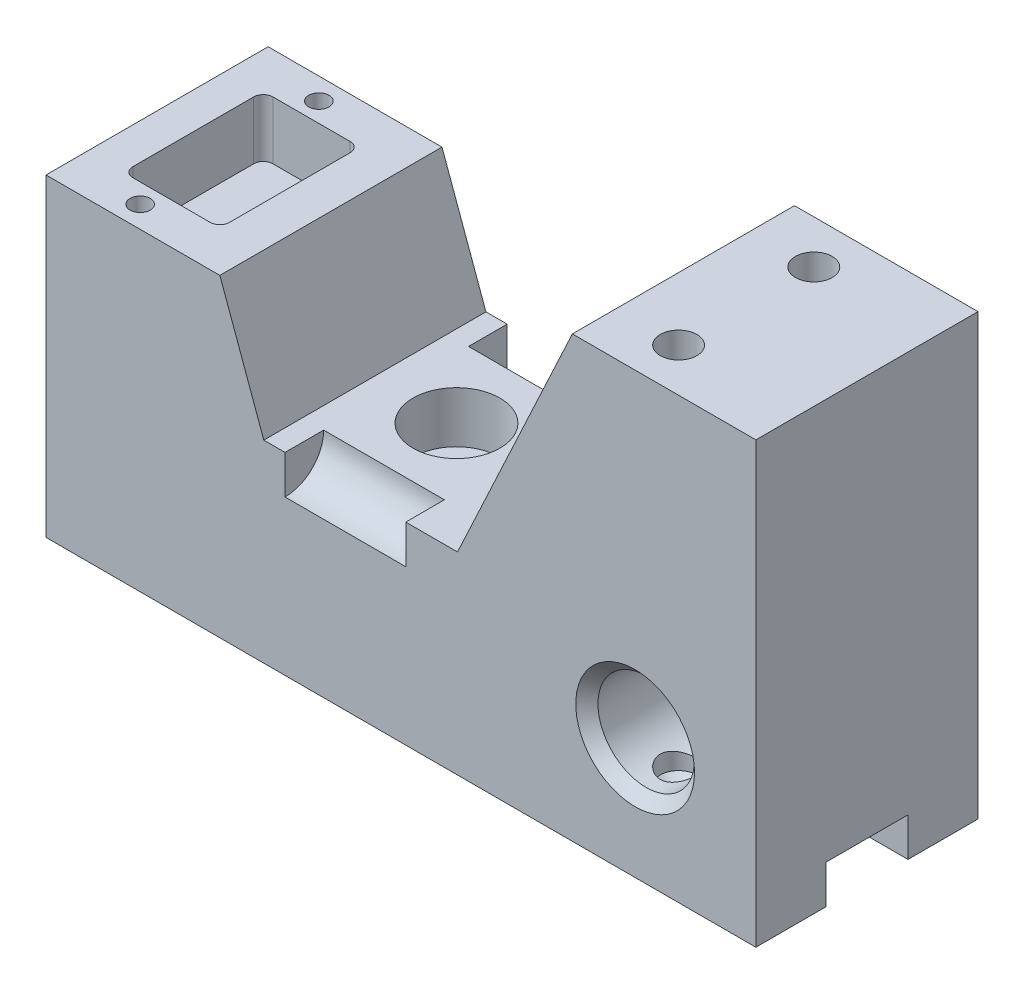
SolidWorks part; units mm, degrees
ref_plane "Front" through (0, 0, 0) normal (0, 0, 1) x (1, 0, 0)
ref_plane "Top" through (0, 0, 0) normal (0, 1, 0) x (1, 0, 0)
ref_plane "Right" through (0, 0, 0) normal (1, 0, 0) x (0, 0, -1)
sketch "Sketch1" plane through (0, 0, 0) normal (0, 0, 1) x (1, 0, 0)
  line L0 (0, 0) -> (0, 65)
  line L1 (0, 65) -> (36, 65)
  line L2 (36, 65) -> (45.0993, 40)
  line L3 (45.0993, 40) -> (85.2183, 40)
  line L4 (85.2183, 40) -> (109, 91)
  line L5 (109, 91) -> (147, 91)
  line L6 (147, 91) -> (147, 0)
  line L7 (147, 0) -> (0, 0)
  circle A0 centre (122, 25) radius 10
  dimension "D5" = 20
  dimension "D1" = 147
  dimension "D2" = 65
  dimension "D3" = 91
  dimension "D4" = 38
  dimension "D6" = 25
  dimension "D7" = 25
  dimension "D8" = 40
  dimension "D9" = 36
  dimension "D10" = 70
  dimension "D11" = 65
extrude "Boss-Extrude1" add sketch "Sketch1" along normal mid plane 46
chamfer "Chamfer1" distance 2.3 angle 45 2 edges at (132, 25, -23) (132, 25, 23)
sketch "Sketch2" plane through (0, 65, 0) normal (0, 1, 0) x (1, 0, 0)
  line L0 (36, -23) -> (0, -23) construction
  line L1 (7.5, 14.5) -> (27.5, 14.5)
  line L2 (7.5, 14.5) -> (7.5, -14.5)
  line L3 (7.5, -14.5) -> (27.5, -14.5)
  line L4 (27.5, 14.5) -> (27.5, -14.5)
  line L5 (7.5, 14.5) -> (27.5, -14.5) construction
  line L6 (7.5, -14.5) -> (27.5, 14.5) construction
  line L7 (0, -23) -> (0, 23) construction
  line L8 (17.5, -23) -> (17.5, -14.5) construction
  point P0 (17.5, 0)
  point P7 (17.5, -14.5)
  dimension "D1" = 8.5
  dimension "D2" = 7.5
  dimension "D3" = 20
  dimension "D4" = 29
extrude "Cut-Extrude1" cut sketch "Sketch2" against normal blind 12
fillet "Fillet1" radius 2 4 edges at (7.5, 59, 14.5) (27.5, 59, 14.5) (27.5, 59, -14.5) (7.5, 59, -14.5)
hole_wizard "Ø7.6 (7.6) Diameter Hole1" positions "Sketch3" profile "Sketch5" hole size "Ø7.6" standard "ISO"
sketch "Sketch3" plane through (0, 91, 0) normal (0, 1, 0) x (1, 0, 0)
  line L0 (122, -23) -> (122, -14) construction
  line L1 (147, -23) -> (109, -23) construction
  line L2 (122, -14) -> (122, 14) construction
  line L3 (122, 14) -> (122, 23) construction
  line L4 (147, 23) -> (109, 23) construction
  line L7 (147, -23) -> (147, 23) construction
  point P0 (122, -14)
  point P2 (122, 14)
  dimension "D1" = 9
  dimension "D2" = 25
sketch "Sketch5" plane through (122, 91, 14) normal (1, 0, 0) x (0, 0, 1)
  line L0 (0, 0) -> (0, 81.2833)
  line L1 (0, 81.2833) -> (3.8, 79)
  line L2 (3.8, 79) -> (3.8, 0)
  line L5 (3.8, 0) -> (0, 0)
  line L10 (0, 81.2833) -> (-3.8, 79) construction
  line L11 (0, -6.35) -> (0, 107.95) construction
  dimension "Hole Dia." = 7.6
  dimension "Hole Depth" = 79
  dimension "Drill Angle" = 118
sketch "Sketch6" plane through (147, 0, 0) normal (1, 0, 0) x (0, 0, -1)
  line L0 (-23, 0) -> (23, 0) construction
  line L1 (8.5, 0) -> (-8.5, 0)
  line L2 (8.5, 0) -> (8.5, 8)
  line L3 (8.5, 8) -> (-8.5, 8)
  line L4 (-8.5, 0) -> (-8.5, 8)
  dimension "D1" = 8
  dimension "D2" = 17
extrude "Cut-Extrude2" cut sketch "Sketch6" against normal through all
hole_wizard "CBORE for M10 Hex Socket Head Cap Screw1" positions "Sketch9" profile "Sketch8" counterbore size "M10" standard "ISO"
sketch "Sketch9" plane through (0, 40, 0) normal (0, 1, 0) x (1, 0, 0)
  line L0 (147, -23) -> (147, 23) construction
  point P0 (62, 0)
  dimension "D1" = 85
sketch "Sketch8" plane through (62, 40, 0) normal (1, 0, 0) x (0, 0, 1)
  line L0 (0, 0) -> (0, 86.3047)
  line L1 (0, 86.3047) -> (5.5, 83)
  line L2 (5.5, 83) -> (5.5, 10.6)
  line L3 (5.5, 10.6) -> (9, 10.6)
  line L4 (9, 10.6) -> (9, 0)
  line L5 (9, 0) -> (0, 0)
  line L10 (0, 86.3047) -> (-5.5, 83) construction
  line L11 (0, -6.35) -> (0, 107.95) construction
  dimension "Hole Dia." = 11
  dimension "Hole Depth" = 83
  dimension "C'Bore Dia." = 18
  dimension "C'Bore Depth" = 10.6
  dimension "Drill Angle" = 118
hole_wizard "M5 Tapped Hole1" positions "Sketch10" profile "Sketch11" tap size "M5" standard "ISO"
sketch "Sketch10" plane through (0, 65, 0) normal (0, 1, 0) x (1, 0, 0)
  line L0 (15, -23) -> (15, -18.5) construction
  line L1 (36, -23) -> (0, -23) construction
  line L3 (15, 18.5) -> (15, 23) construction
  line L4 (36, 23) -> (0, 23) construction
  line L6 (15, 18.5) -> (15, 14.5) construction
  line L7 (25.5, 14.5) -> (9.5, 14.5) construction
  line L8 (15, 14.5) -> (15, -14.5) construction
  line L9 (9.5, -14.5) -> (25.5, -14.5) construction
  line L10 (15, -14.5) -> (15, -18.5) construction
  line L12 (0, -23) -> (0, 23) construction
  point P0 (15, -18.5)
  point P2 (15, 18.5)
  dimension "D1" = 4.5
  dimension "D2" = 15
sketch "Sketch11" plane through (15, 65, 18.5) normal (1, 0, 0) x (0, 0, 1)
  line L0 (0, 0) -> (0, 13.6618)
  line L1 (0, 13.6618) -> (2.1, 12.4)
  line L2 (2.1, 12.4) -> (2.1, 0)
  line L5 (2.1, 0) -> (0, 0)
  line L10 (0, 13.6618) -> (-2.1, 12.4) construction
  line L11 (0, -6.35) -> (0, 107.95) construction
  dimension "Tap Drill Dia." = 4.2
  dimension "Tap Drill Depth" = 12.4
  dimension "Drill Angle" = 118
ref_plane "Plane1" through (62, 0, 0) normal (1, 0, 0) x (0, 0, -1)
sketch "Sketch13" plane through (62, 0, 0) normal (1, 0, 0) x (0, 0, -1)
  circle A0 centre (-23, 40) radius 8
  dimension "D1" = 16
extrude "Cut-Extrude3" cut sketch "Sketch13" against normal mid plane 25
mirror "Mirror1" about plane through (0, 0, 0) normal (0, 0, 1) of "Cut-Extrude3"
